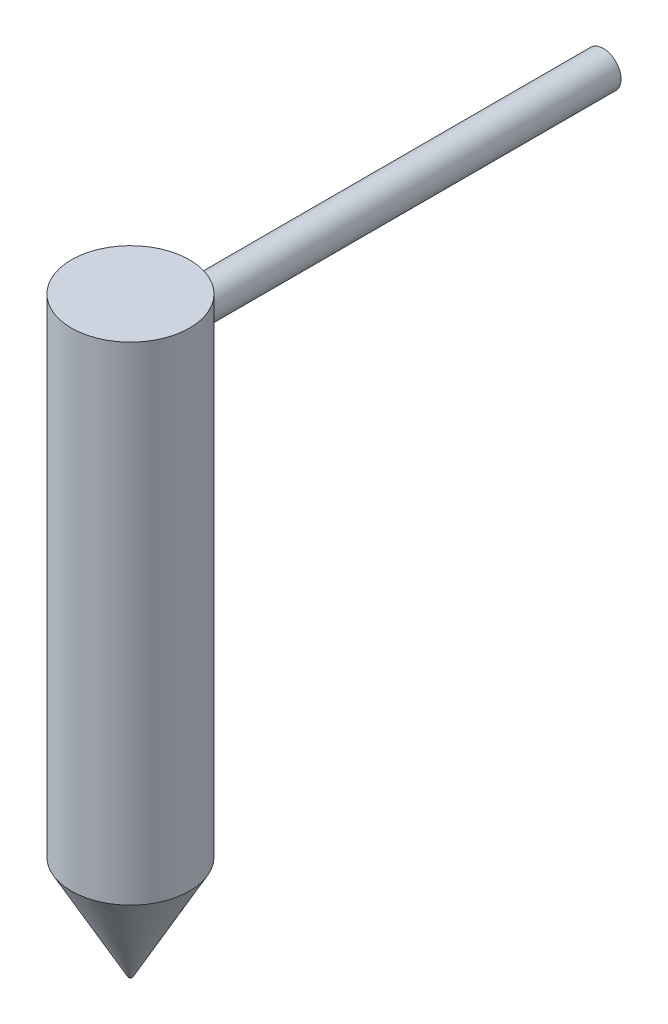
SolidWorks part; units mm, degrees
ref_plane "Front Plane" through (0, 0, 0) normal (0, 0, 1) x (1, 0, 0)
ref_plane "Top Plane" through (0, 0, 0) normal (0, 1, 0) x (1, 0, 0)
ref_plane "Right Plane" through (0, 0, 0) normal (1, 0, 0) x (0, 0, -1)
sketch "Sketch1" plane through (0, 0, 0) normal (0, 1, 0) x (1, 0, 0)
  circle A0 centre (0, 0) radius 50
extrude "Boss-Extrude1" add sketch "Sketch1" against normal blind 500
sketch "Sketch2" plane through (0, 0, 0) normal (1, 0, 0) x (0, 0, -1)
  line L0 (1.5987, -500) -> (62.9784, -388.9841)
  line L1 (-50, -500) -> (50, -500) construction
  line L2 (62.9784, -388.9841) -> (72.8552, -539.3971)
  line L3 (72.8552, -539.3971) -> (1.5987, -500)
  line L4 (0, -485.208) -> (0, -531.4847) construction
revolve "Cut-Revolve1" cut sketch "Sketch2" angle 360 about L4
sketch "Sketch3" plane through (0, 0, 0) normal (0, 0, 1) x (1, 0, 0)
  circle A0 centre (0, -35.1316) radius 15
extrude "Boss-Extrude2" add sketch "Sketch3" against normal blind 400
